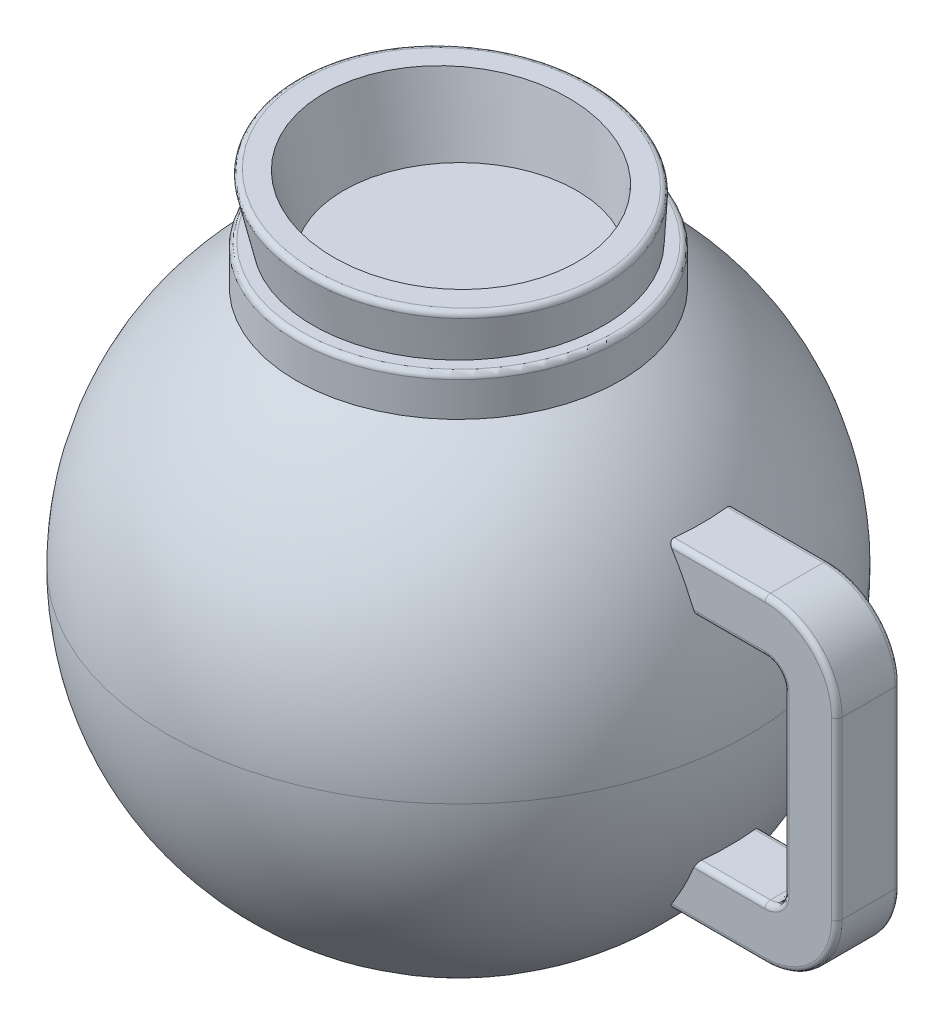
SolidWorks part; units mm, degrees
ref_plane "Front Plane" through (0, 0, 0) normal (0, 0, 1) x (1, 0, 0)
ref_plane "Top Plane" through (0, 0, 0) normal (0, 1, 0) x (1, 0, 0)
ref_plane "Right Plane" through (0, 0, 0) normal (1, 0, 0) x (0, 0, -1)
sketch "Sketch2" plane through (0, 0, 0) normal (0, 0, 1) x (1, 0, 0)
  line L0 (0, 0) -> (-30.6213, 0)
  line L1 (-30.6213, 91.3844) -> (30.6213, 91.3844)
  line L2 (46.0447, 75.7831) -> (63.9553, 75.7831)
  line L3 (77.5, 62.2384) -> (77.5, 29.1455)
  line L4 (63.9553, 15.6008) -> (46.0447, 15.6013)
  line L5 (46.0447, 15.6013) -> (46.0431, 15.6013)
  line L6 (51.2135, 25.6013) -> (63.9553, 25.6013)
  line L7 (67.5, 29.146) -> (67.5, 62.2384)
  line L8 (63.9553, 65.7831) -> (51.2135, 65.7831)
  line L9 (46.0431, 75.7831) -> (46.0447, 75.7831)
  line L10 (-30.6213, 91.3844) -> (30.6213, 91.3844)
  line L11 (30.6213, 91.3844) -> (30.6213, 98.8844)
  line L12 (30.6213, 98.8844) -> (-30.6213, 98.8844)
  line L13 (-30.6213, 98.8844) -> (-30.6213, 91.3844)
  line L14 (-27.5, 98.8844) -> (27.5, 98.8844)
  line L15 (27.5, 98.8844) -> (27.5, 106.3844)
  line L16 (27.5, 106.3844) -> (-30.6213, 110.8602)
  line L17 (-30.6213, 110.8602) -> (-27.5, 98.8844)
  line L18 (0, 91.3844) -> (0, 0)
  spline S0 degree 3 poles (46.0447, 75.7831) (48.0924, 72.6565) (49.8302, 69.3086) (51.2145, 65.7831) knots 0.069442 0.069442 0.069442 0.069442 0.104601 0.104601 0.104601 0.104601
  spline S1 degree 3 poles (51.2145, 25.6013) (49.8302, 22.0758) (48.0924, 18.728) (46.0447, 15.6013) knots 0.228732 0.228732 0.228732 0.228732 0.263891 0.263891 0.263891 0.263891
  spline S2 degree 3 poles (-30.6213, 0) (-45.3236, 9.8725) (-55, 26.6518) (-55, 45.6922) knots 0.5 0.5 0.5 0.5 0.666667 0.666667 0.666667 0.666667
  spline S3 degree 3 poles (-55, 45.6922) (-55, 64.7326) (-45.3236, 81.5119) (-30.6213, 91.3844) knots 0.666667 0.666667 0.666667 0.666667 0.833333 0.833333 0.833333 0.833333
  spline S4 degree 3 poles (63.9553, 75.7831) (71.4049, 75.7831) (77.5, 69.688) (77.5, 62.2384) knots 0.071429 0.071429 0.071429 0.071429 0.142857 0.142857 0.142857 0.142857
  spline S5 degree 3 poles (77.5, 29.1455) (77.5, 21.6959) (71.4049, 15.6008) (63.9553, 15.6008) knots 0.214286 0.214286 0.214286 0.214286 0.285714 0.285714 0.285714 0.285714
  spline S6 degree 3 poles (46.0431, 15.6013) (48.091, 18.7281) (49.8289, 22.0758) (51.2135, 25.6013) knots 0.428571 0.428571 0.428571 0.428571 0.5 0.5 0.5 0.5
  spline S7 degree 3 poles (63.9553, 25.6013) (65.8851, 25.6013) (67.5, 27.2162) (67.5, 29.146) knots 0.571429 0.571429 0.571429 0.571429 0.642857 0.642857 0.642857 0.642857
  spline S8 degree 3 poles (67.5, 62.2384) (67.5, 64.1682) (65.8851, 65.7831) (63.9553, 65.7831) knots 0.714286 0.714286 0.714286 0.714286 0.785714 0.785714 0.785714 0.785714
  spline S9 degree 3 poles (51.2135, 65.7831) (49.8289, 69.3086) (48.091, 72.6563) (46.0431, 75.7831) knots 0.857143 0.857143 0.857143 0.857143 0.928571 0.928571 0.928571 0.928571
revolve "Revolve1" add sketch "Sketch2" angle 360 about L18
sketch "Sketch3" plane through (0, 0, 0) normal (0, 0, 1) x (1, 0, 0)
  line L1 (-30.6213, 98.8844) -> (0, 98.8844)
  line L2 (-30.6213, 98.8844) -> (-30.6213, 91.3844)
  line L3 (-30.6213, 91.3844) -> (0, 91.3844)
  line L4 (0, 98.8844) -> (0, 91.3844)
revolve "Revolve2" add sketch "Sketch3" angle 360 about L4
sketch "Sketch4" plane through (0, 98.8844, 0) normal (0, 1, 0) x (1, 0, 0)
  line L0 (30.6213, 0) -> (-30.6213, 0) construction
  circle A0 centre (0, 0) radius 27.5
ref_plane "Plane3" through (8.3063, 107.8625, 0) normal (0.0768, 0.997, 0) x (-0.997, 0.0768, 0)
sketch "Sketch8" plane through (8.3063, 107.8625, 0) normal (0.0768, 0.997, 0) x (-0.997, 0.0768, 0)
  line L0 (39.0428, 0) -> (-19.2506, 0) construction
  circle A0 centre (9.8961, 0) radius 29.1467
loft "Loft1" add profiles "Sketch8", "Sketch4"
shell "Shell1" thickness 5
sketch "Sketch9" plane through (0, 0, 0) normal (0, 0, 1) x (1, 0, 0)
  line L0 (46.0431, 75.7831) -> (46.0447, 75.7831) construction
  line L1 (63.9553, 65.7831) -> (51.2135, 65.7831) construction
  line L2 (67.5, 29.146) -> (67.5, 62.2384) construction
  line L3 (51.2135, 25.6013) -> (63.9553, 25.6013) construction
  line L4 (46.0447, 15.6013) -> (46.0431, 15.6013) construction
  line L5 (63.9553, 15.6008) -> (46.0447, 15.6013) construction
  line L6 (77.5, 62.2384) -> (77.5, 29.1455) construction
  line L7 (46.0447, 75.7831) -> (63.9553, 75.7831) construction
  line L8 (46.0431, 75.7831) -> (46.0447, 75.7831)
  line L9 (63.9553, 65.7831) -> (51.2135, 65.7831)
  line L10 (67.5, 29.146) -> (67.5, 62.2384)
  line L11 (51.2135, 25.6013) -> (63.9553, 25.6013)
  line L12 (46.0447, 15.6013) -> (46.0431, 15.6013)
  line L13 (63.9553, 15.6008) -> (46.0447, 15.6013)
  line L14 (77.5, 62.2384) -> (77.5, 29.1455)
  line L15 (46.0447, 75.7831) -> (63.9553, 75.7831)
  line L16 (33.1095, 65.7831) -> (33.1095, 15.6013) construction
  line L17 (51.2135, 65.7831) -> (33.1095, 65.7831)
  line L19 (51.2135, 75.7831) -> (33.1095, 75.7831)
  line L20 (33.1095, 65.7831) -> (33.1095, 75.7831)
  line L21 (54.0897, 25.6013) -> (33.1095, 25.6013)
  line L23 (54.117, 15.6013) -> (33.1095, 15.6013)
  line L24 (33.1095, 25.6013) -> (33.1095, 15.6013)
  spline S1 degree 3 poles (-2412.1564, 1740.542) (2338.2122, -1939.4275) (-1937.7057, 2336.4915) (1742.2479, -2413.8591) knots -0.091122 -0.091122 -0.091122 -0.091122 1.59112 1.59112 1.59112 1.59112 only from (67.5, 62.2384) to (63.9553, 65.7831) construction
  spline S2 degree 3 poles (1742.2589, 2505.2577) (-1937.7106, -2245.1109) (2338.2084, 2030.807) (-2412.1422, -1649.1466) knots -0.233979 -0.233979 -0.233979 -0.233979 1.448263 1.448263 1.448263 1.448263 only from (63.9553, 25.6013) to (67.5, 29.146) construction
  spline S4 degree 3 poles (-2579.5722, -1329.2507) (2441.8743, 1953.1856) (-1860.0625, -2348.7586) (1422.3105, 2672.6102) knots -0.295667 -0.295667 -0.295667 -0.295667 0.795662 0.795662 0.795662 0.795662 only from (77.5, 29.1455) to (63.9553, 15.6008) construction
  spline S5 degree 3 poles (1422.3516, -2581.2891) (-1860.0847, 2440.1574) (2441.8594, -1861.7794) (-2579.5093, 1420.5936) knots -0.438524 -0.438524 -0.438524 -0.438524 0.652805 0.652805 0.652805 0.652805 only from (63.9553, 75.7831) to (77.5, 62.2384) construction
  spline S7 degree 3 poles (67.5, 62.2384) (67.5, 64.1682) (65.8851, 65.7831) (63.9553, 65.7831) knots 0.714286 0.714286 0.714286 0.714286 0.785714 0.785714 0.785714 0.785714
  spline S8 degree 3 poles (63.9553, 25.6013) (65.8851, 25.6013) (67.5, 27.2162) (67.5, 29.146) knots 0.571429 0.571429 0.571429 0.571429 0.642857 0.642857 0.642857 0.642857
  spline S10 degree 3 poles (77.5, 29.1455) (77.5, 21.6959) (71.4049, 15.6008) (63.9553, 15.6008) knots 0.214286 0.214286 0.214286 0.214286 0.285714 0.285714 0.285714 0.285714
  spline S11 degree 3 poles (63.9553, 75.7831) (71.4049, 75.7831) (77.5, 69.688) (77.5, 62.2384) knots 0.071429 0.071429 0.071429 0.071429 0.142857 0.142857 0.142857 0.142857
  point P17 (33.1095, 25.6013)
  point P19 (33.0752, 16.0075)
extrude "Boss-Extrude1" add sketch "Sketch9" along normal mid plane 12
fillet "Fillet1" radius 1 2 edges at (-30.6213, 110.8602, 0) (0, 98.8844, 30.6213)
fillet "Fillet2" radius 1 24 edges at (51.0377, 65.7831, -6) (57.5844, 65.7831, -6) (67.5, 45.6922, -6) (57.4086, 25.6013, 6) (51.0377, 65.7831, 6) (57.5844, 65.7831, 6) (54.8037, 75.7831, -6) (45.8484, 15.6013, -6) (55, 15.6011, -6) (77.5, 45.692, -6) (54.8037, 75.7831, 6) (45.8484, 15.6013, 6) (55, 15.6011, 6) (77.5, 45.692, 6) (57.4086, 25.6013, -6) (67.5, 45.6922, 6)
